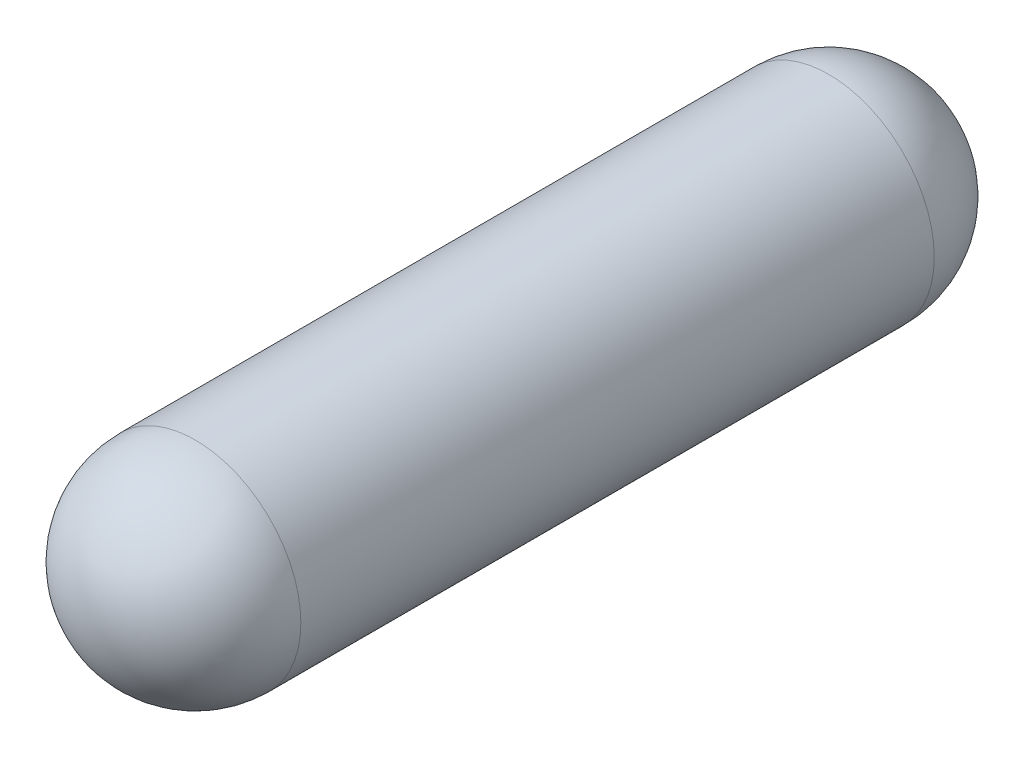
SolidWorks part; units mm, degrees
ref_plane "Plan1" through (0, 0, 0) normal (0, 0, 1) x (1, 0, 0)
ref_plane "Plan2" through (0, 0, 0) normal (0, 1, 0) x (1, 0, 0)
ref_plane "Plan3" through (0, 0, 0) normal (1, 0, 0) x (0, 0, -1)
sketch "Esquisse1" plane through (0, 0, 0) normal (0, 0, 1) x (1, 0, 0)
  circle A0 centre (0, 0) radius 1
  dimension "D1" = 2
extrude "cylindre" add sketch "Esquisse1" along normal mid plane 6
dome "Dôme1" faces to dome 1 distance 1 parameters "D1"=1
dome "Dôme2" faces to dome 1 distance 1 parameters "D1"=1
